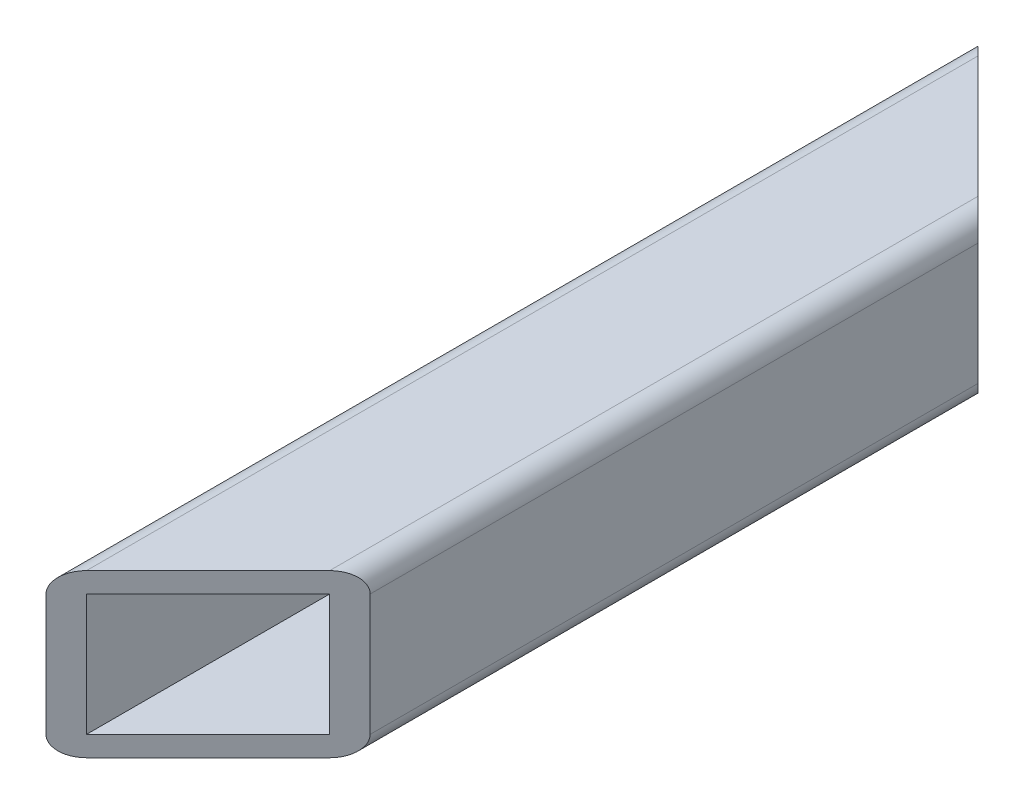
SolidWorks part; units mm, degrees
ref_plane "Front Plane" through (0, 0, 0) normal (0, 0, 1) x (1, 0, 0)
ref_plane "Top Plane" through (0, 0, 0) normal (0, 1, 0) x (1, 0, 0)
ref_plane "Right Plane" through (0, 0, 0) normal (1, 0, 0) x (0, 0, -1)
sketch "Sketch1" plane through (0, 0, 0) normal (0, 0, 1) x (1, 0, 0)
  line L0 (-19.05, -19.05) -> (-19.05, 19.05)
  line L1 (-19.05, -25.4) -> (19.05, -25.4)
  line L2 (-25.4, -19.05) -> (-25.4, 19.05)
  line L3 (-19.05, 25.4) -> (19.05, 25.4)
  line L4 (25.4, -19.05) -> (25.4, 19.05)
  line L5 (-19.05, 19.05) -> (19.05, 19.05)
  line L6 (19.05, -19.05) -> (19.05, 19.05)
  line L7 (-19.05, -19.05) -> (19.05, -19.05)
  arc A0 (-19.05, -25.4) -> (-25.4, -19.05) centre (-19.05, -19.05) cw
  arc A1 (19.05, -25.4) -> (25.4, -19.05) centre (19.05, -19.05) ccw
  arc A2 (19.05, 25.4) -> (25.4, 19.05) centre (19.05, 19.05) cw
  arc A3 (-25.4, 19.05) -> (-19.05, 25.4) centre (-19.05, 19.05) cw
  arc A4 (-19.05, 19.05) -> (-19.05, 19.05) centre (-19.05, 19.05) cw
  arc A5 (19.05, 19.05) -> (19.05, 19.05) centre (19.05, 19.05) cw
  arc A6 (19.05, -19.05) -> (19.05, -19.05) centre (19.05, -19.05) ccw
  arc A7 (-19.05, -19.05) -> (-19.05, -19.05) centre (-19.05, -19.05) cw
  dimension "D5" = 6.35
  dimension "D1" = 50.8
  dimension "D2" = 50.8
  dimension "D3" = 25.4
  dimension "D4" = 25.4
  dimension "D6" = 6.35
extrude "Boss-Extrude1" add sketch "Sketch1" against normal blind 292.1
sketch "Sketch3" plane through (0, 25.4, 0) normal (0, 1, 0) x (1, 0, 0)
  line L0 (-25.4, 292.1) -> (25.4, 241.3)
  line L1 (25.4, 292.1) -> (25.4, 0) construction
  line L2 (25.4, 241.3) -> (25.4, 292.1)
  line L3 (25.4, 292.1) -> (-25.4, 292.1)
  line L4 (-25.4, 0) -> (25.4, 50.8)
  line L5 (25.4, 0) -> (-25.4, 0)
  line L6 (25.4, 50.8) -> (25.4, 0)
  dimension "D1" = 45
  dimension "D2" = 45
extrude "Cut-Extrude1" cut sketch "Sketch3" against normal through all
